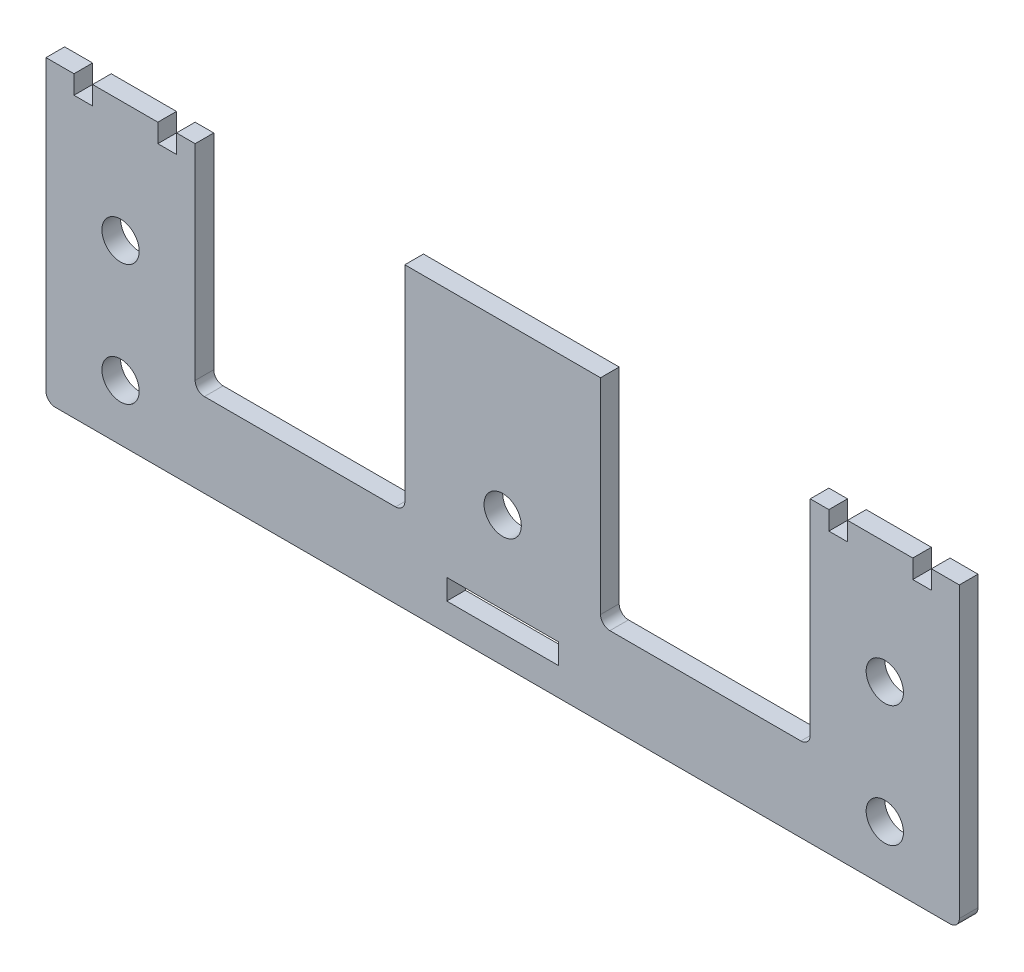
SolidWorks part; units mm, degrees
ref_plane "Plan de face" through (0, 0, 0) normal (0, 0, 1) x (1, 0, 0)
ref_plane "Plan de dessus" through (0, 0, 0) normal (0, 1, 0) x (1, 0, 0)
ref_plane "Plan de droite" through (0, 0, 0) normal (1, 0, 0) x (0, 0, -1)
sketch "Esquisse1" plane through (0, 0, 0) normal (0, 0, 1) x (1, 0, 0)
  line L0 (0, 0) -> (0, 54.4159) construction
  line L1 (-24, 0) -> (24, 0)
  line L2 (-24.5, 0.5) -> (-24.5, 16)
  line L3 (-24.5, 16) -> (-23, 16)
  line L4 (24.5, 0.5) -> (24.5, 16)
  line L5 (-5.25, 16) -> (5.25, 16)
  line L6 (-16.5, 16) -> (-16.5, 5)
  line L7 (-16, 4.5) -> (-5.75, 4.5)
  line L8 (-5.25, 16) -> (-5.25, 5)
  line L9 (-23, 16) -> (-23, 15)
  line L10 (5.25, 16) -> (5.25, 5)
  line L11 (5.75, 4.5) -> (16, 4.5)
  line L12 (16.5, 16) -> (16.5, 5)
  line L13 (16.5, 16) -> (17.5, 16)
  line L14 (-3, 2.6) -> (3, 2.6)
  line L15 (-3, 2.6) -> (-3, 1.5)
  line L16 (-3, 1.5) -> (3, 1.5)
  line L17 (3, 2.6) -> (3, 1.5)
  line L18 (18.5, 16) -> (22, 16)
  line L19 (17.5, 16) -> (17.5, 15)
  line L20 (17.5, 15) -> (18.5, 15)
  line L21 (18.5, 16) -> (18.5, 15)
  line L22 (-17.5, 16) -> (-16.5, 16)
  line L23 (22, 16) -> (22, 15)
  line L24 (22, 15) -> (23, 15)
  line L25 (23, 16) -> (23, 15)
  line L26 (-22, 15) -> (-23, 15)
  line L27 (-22, 16) -> (-22, 15)
  line L28 (-18.5, 16) -> (-22, 16)
  line L29 (-18.5, 16) -> (-18.5, 15)
  line L30 (-17.5, 15) -> (-18.5, 15)
  line L31 (-17.5, 16) -> (-17.5, 15)
  line L33 (23, 16) -> (24.5, 16)
  arc A0 (24, 0) -> (24.5, 0.5) centre (24, 0.5) ccw
  arc A1 (16, 4.5) -> (16.5, 5) centre (16, 5) ccw
  arc A2 (5.25, 5) -> (5.75, 4.5) centre (5.75, 5) ccw
  arc A3 (-5.75, 4.5) -> (-5.25, 5) centre (-5.75, 5) ccw
  arc A4 (-16.5, 5) -> (-16, 4.5) centre (-16, 5) ccw
  arc A5 (-24, 0) -> (-24.5, 0.5) centre (-24, 0.5) cw
  circle A6 centre (20.5, 3) radius 1
  circle A7 centre (20.5, 9.5) radius 1
  circle A8 centre (0, 7) radius 1
  circle A9 centre (-20.5, 9.5) radius 1
  circle A10 centre (-20.5, 3) radius 1
  point P17 (24.5, 0)
  point P28 (-24.5, 0)
  dimension "D6" = 0.5
  dimension "D7" = 2
  dimension "D1" = 49
  dimension "D2" = 10.5
  dimension "D3" = 8
  dimension "D4" = 4.5
  dimension "D5" = 16
  dimension "D8" = 3
  dimension "D9" = 4
  dimension "D10" = 6.5
  dimension "D11" = 4
  dimension "D12" = 7
  dimension "D13" = 6
  dimension "D14" = 1.1
  dimension "D15" = 1.5
  dimension "D16" = 1
  dimension "D17" = 1.5
  dimension "D18" = 3.5
  dimension "D19" = 1
  dimension "D20" = 3.5
extrude "Extrusion1" add sketch "Esquisse1" along normal blind 1
